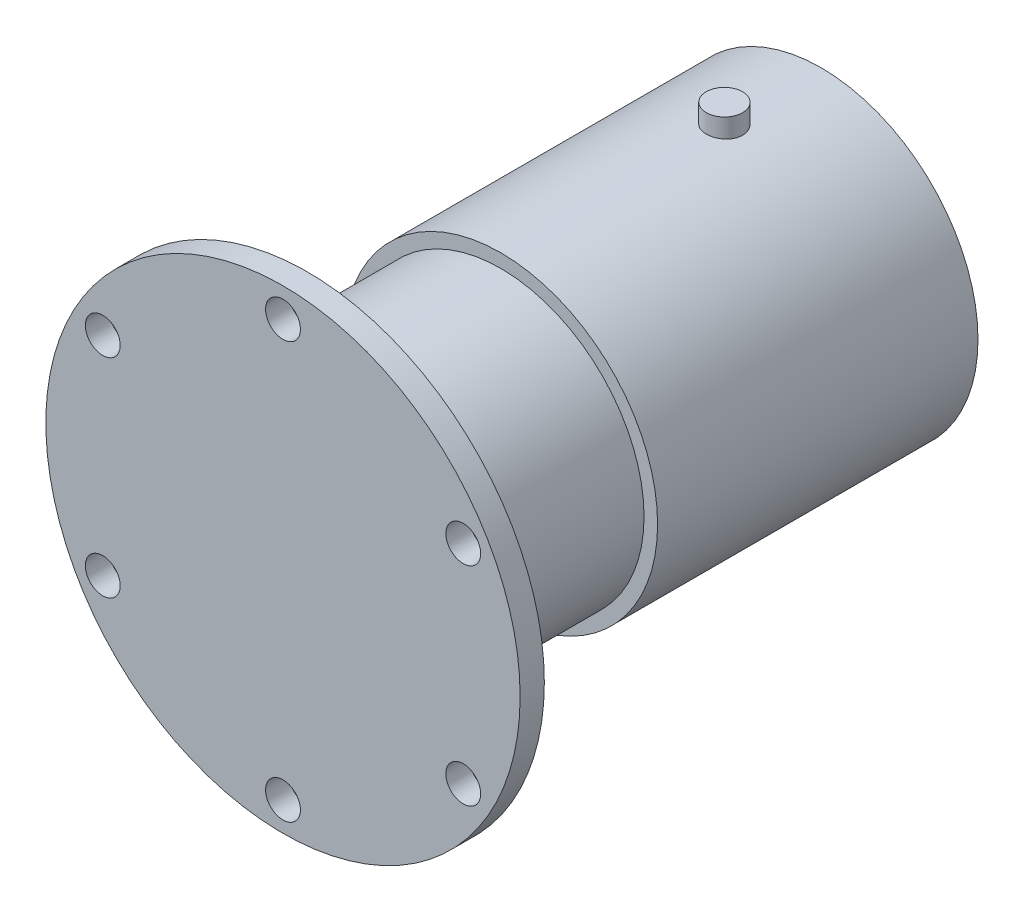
SolidWorks part; units mm, degrees
ref_plane "Front" through (0, 0, 0) normal (0, 0, 1) x (1, 0, 0)
ref_plane "Top" through (0, 0, 0) normal (0, 1, 0) x (1, 0, 0)
ref_plane "Right" through (0, 0, 0) normal (1, 0, 0) x (0, 0, -1)
mirrored part "1030807-HV-OCEAN DESIGN_Mirrored"
other "<1030807-HV-OCEAN DESIGN>-<Extrude2>"
other "<1030807-HV-OCEAN DESIGN>-<Extrude6>"
other "<1030807-HV-OCEAN DESIGN>-<CirPattern1>"
